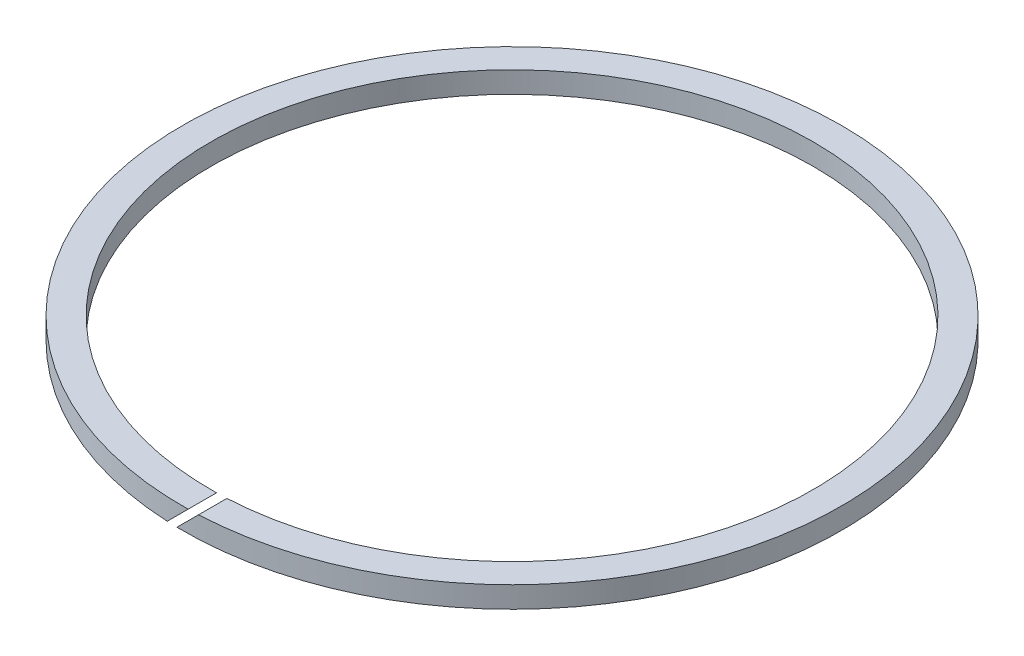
SolidWorks part; units mm, degrees
ref_plane "Front Plane" through (0, 0, 0) normal (0, 0, 1) x (1, 0, 0)
ref_plane "Top Plane" through (0, 0, 0) normal (0, 1, 0) x (1, 0, 0)
ref_plane "Right Plane" through (0, 0, 0) normal (1, 0, 0) x (0, 0, -1)
sketch "Sketch1" plane through (0, 0, 0) normal (0, 1, 0) x (1, 0, 0)
  circle A0 centre (0, 0) radius 46.5
  circle A1 centre (0, 0) radius 42.5
  dimension "D1" = 93
  dimension "D2" = 85
extrude "Boss-Extrude1" add sketch "Sketch1" along normal mid plane 3
sketch "Sketch4" plane through (0, 0, 0) normal (0, 0, 1) x (1, 0, 0)
  line L0 (8.5956, 8.5956) -> (-8.5956, -8.5956)
  line L1 (0, -7.86) -> (0, 7.86) construction
  line L2 (-6.3184, 0) -> (6.8292, 0) construction
  point P4 (0, 0)
  point P6 (0, 0)
  dimension "D1" = 135
extrude "Cut-Extrude-Thin1" cut sketch "Sketch4" against normal blind 3 and the other way through all thin
